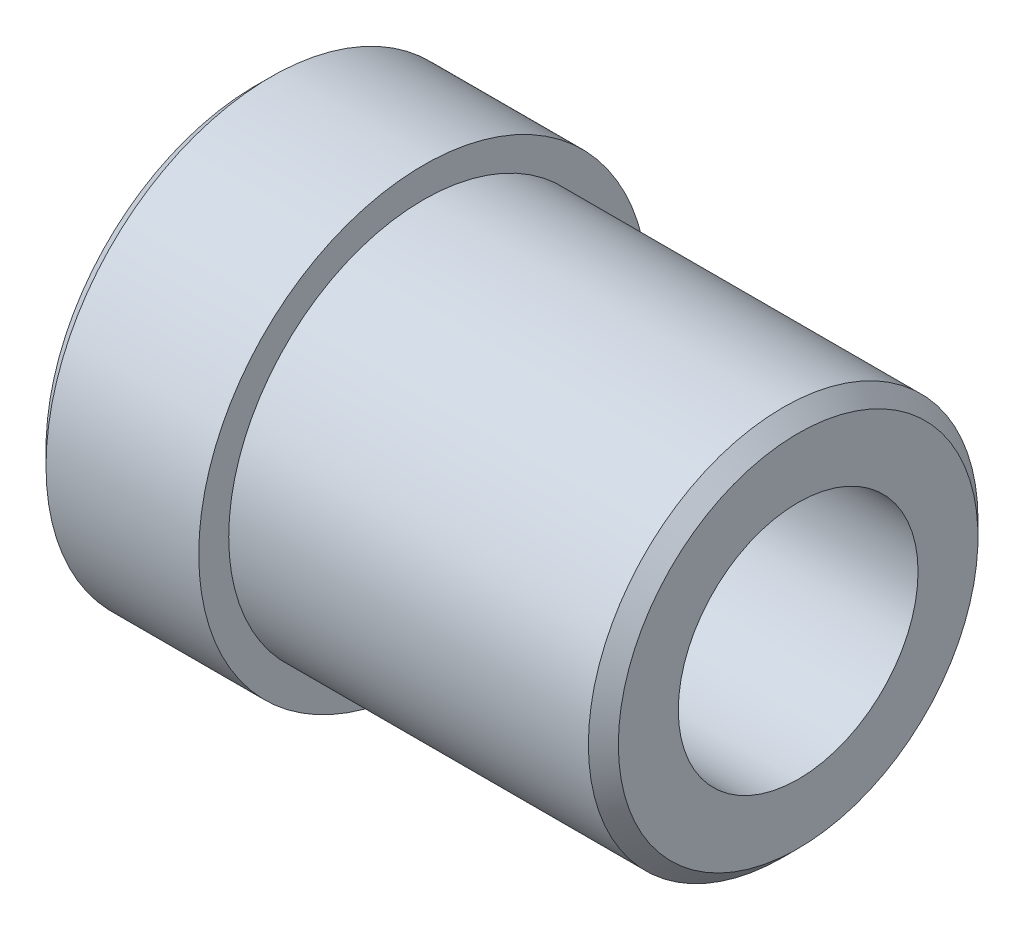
SolidWorks part; units mm, degrees
ref_plane "Plane1" through (0, 0, 0) normal (0, 0, 1) x (1, 0, 0)
ref_plane "Plane2" through (0, 0, 0) normal (0, 1, 0) x (1, 0, 0)
ref_plane "Plane3" through (0, 0, 0) normal (1, 0, 0) x (0, 0, -1)
sketch "Esquisse1" plane through (0, 0, 0) normal (0, 0, 1) x (1, 0, 0)
  line L0 (0, 0) -> (38.5536, 0) construction
  line L1 (0, 8) -> (36.193, 8)
  line L2 (36.193, 8) -> (36.193, 13)
  line L3 (36.193, 13) -> (11.193, 13)
  line L4 (11.193, 13) -> (11.193, 15)
  line L5 (11.193, 15) -> (0, 15)
  line L6 (0, 15) -> (0, 8)
  dimension "D1" = 13
  dimension "D2" = 8
  dimension "D3" = 25
  dimension "D4" = 15
revolve "Base-Révolution" add sketch "Esquisse1" angle 360 about L0
chamfer "Chanfrein1" distance 1 angle 45
chamfer "Chanfrein2" distance 1 angle 45
